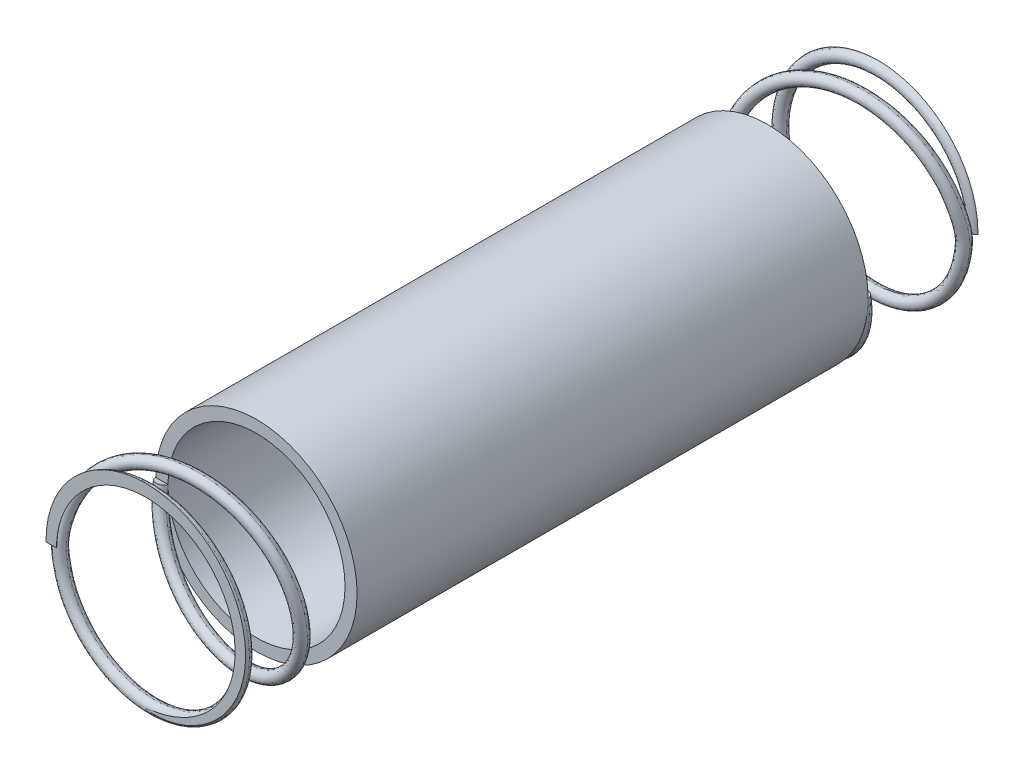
SolidWorks part; units mm, degrees
ref_plane "Front Plane" through (0, 0, 0) normal (0, 0, 1) x (1, 0, 0)
ref_plane "Top Plane" through (0, 0, 0) normal (0, 1, 0) x (1, 0, 0)
ref_plane "Right Plane" through (0, 0, 0) normal (1, 0, 0) x (0, 0, -1)
imported_body "Imported1"
sketch "Schizzo1" plane through (0, 0, 0) normal (0, 1, 0) x (1, 0, 0)
  line L0 (0, 0) -> (-0.0001, -159) construction
  line L6 (12.4999, -122.6) -> (-12.5001, -122.6)
  line L7 (12.4999, -122.6) -> (12.4999, -36.4)
  line L8 (12.4999, -36.4) -> (-12.5001, -36.4)
  line L9 (-12.5001, -122.6) -> (-12.5001, -36.4)
  line L10 (12.4999, -122.6) -> (-12.5001, -36.4) construction
  line L11 (12.4999, -36.4) -> (-12.5001, -122.6) construction
  point P0 (-0.0001, -79.5)
  point P1 (-13.1429, -37.3)
  dimension "D1" = 86.2
  dimension "D2" = 25
extrude "Taglio-Estrusione1" cut sketch "Schizzo1" along normal mid plane 30
move or copy body "Corpo-Sposta/copia1" bodies to move or copy 104 placed by mates yes
ref_plane "Piano1" through (0, 0, 36.4) normal (0, 0, 1) x (1, 0, 0)
sketch "Schizzo2" plane through (0, 0, 36.4) normal (0, 0, 1) x (1, 0, 0)
  circle A0 centre (0, 0) radius 9.9978
  circle A1 centre (0, 0) radius 8.8
  circle A2 centre (0, 0) radius 8.8 construction
  spline S0 degree 3 poles (-9.9196, -0.0061) (-9.9198, 0.1002) (-9.9202, 0.314) (-9.9073, 0.6365) (-9.8842, 0.9622) (-9.8497, 1.2906) (-9.8037, 1.6214) (-9.7263, 2.0673) (-9.5992, 2.6277) (-9.3975, 3.2979) (-9.1439, 3.9643) (-8.8366, 4.6215) (-8.4752, 5.2649) (-8.0594, 5.8898) (-7.6693, 6.3891) (-7.3302, 6.7746) (-6.813, 7.3183) (-6.2371, 7.8195) (-5.6044, 8.2723) (-5.1016, 8.6002) (-4.5529, 8.9059) (-3.9592, 9.1821) (-3.4755, 9.3774) (-2.9627, 9.553) (-2.4216, 9.7054) (-1.8528, 9.8311) (-1.2574, 9.9254) (-0.6369, 9.9878) (-0.2147, 9.9959) (-0.0001, 10) knots 0 0 0 0 0.020345 0.040934 0.061765 0.082836 0.104143 0.125684 0.169446 0.214088 0.259574 0.305837 0.352876 0.400724 0.449413 0.474084 0.498977 0.593038 0.61981 0.64788 0.707921 0.739896 0.773173 0.807739 0.843593 0.88074 0.919186 0.958936 1 1 1 1 construction
extrude "Estrusione-Estrusione1" add sketch "Schizzo2" along normal mid plane 10
